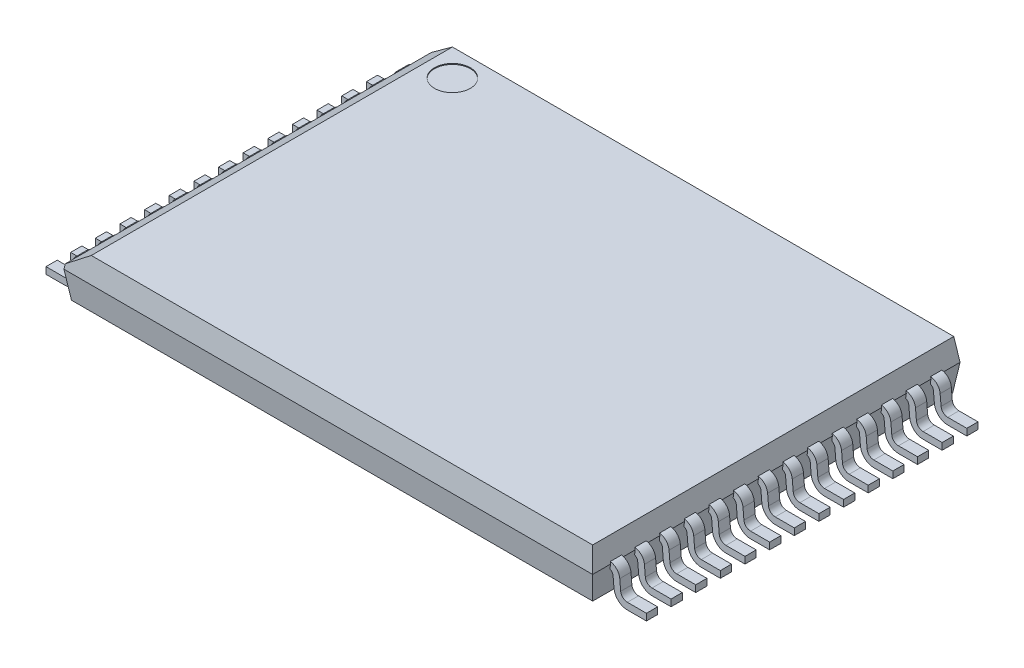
SolidWorks part; units mm, degrees
ref_plane "Front" through (0, 0, 0) normal (0, 0, 1) x (1, 0, 0)
ref_plane "Top" through (0, 0, 0) normal (0, 1, 0) x (1, 0, 0)
ref_plane "Right" through (0, 0, 0) normal (1, 0, 0) x (0, 0, -1)
ref_plane "ПлоскостьВывод1" through (0, 0, -3.575) normal (0, 0, 1) x (1, 0, 0)
sketch "ЭскизВывод1" plane through (0, 0, -3.575) normal (0, 0, 1) x (1, 0, 0)
  line L0 (-6.7, 0) -> (-6.2749, 0)
  line L1 (-5.976, 0.2739) -> (-5.9555, 0.5087)
  line L2 (-5.8559, 0.6) -> (5.8559, 0.6)
  line L3 (0, 0.6) -> (0, 0) construction
  line L4 (5.976, 0.2739) -> (5.9555, 0.5087)
  line L5 (6.7, 0) -> (6.2749, 0)
  arc A0 (-5.9555, 0.5087) -> (-5.8559, 0.6) centre (-5.8559, 0.5) cw
  arc A1 (-6.2749, 0) -> (-5.976, 0.2739) centre (-6.2749, 0.3) ccw
  arc A2 (6.2749, 0) -> (5.976, 0.2739) centre (6.2749, 0.3) cw
  arc A3 (5.9555, 0.5087) -> (5.8559, 0.6) centre (5.8559, 0.5) ccw
  point P8 (-5.9475, 0.6)
  point P11 (-6, 0)
  dimension "D6" = 0.1
  dimension "D7" = 0.3
  dimension "E" = 13.4
  dimension "A_mid_lead" = 0.6
  dimension "L" = 0.7
  dimension "D4" = 85
  dimension "D5" = 11.895
extrude "Вывод1" add sketch "ЭскизВывод1" along normal mid plane 0.25 thin
ref_plane "ПлоскостьКорпус" through (0, 0.7, 0) normal (0, 1, 0) x (-1, 0, 0)
sketch "ЭскизКорпус" plane through (0, 0.7, 0) normal (0, 1, 0) x (1, 0, 0)
  line L1 (5.9, -4.1) -> (-5.9, -4.1)
  line L2 (5.9, -4.1) -> (5.9, 4.1)
  line L3 (5.9, 4.1) -> (-5.9, 4.1)
  line L4 (-5.9, -4.1) -> (-5.9, 4.1)
  line L5 (5.9, -4.1) -> (-5.9, 4.1) construction
  line L6 (5.9, 4.1) -> (-5.9, -4.1) construction
  point P0 (0, 0)
  dimension "D" = 8.2
  dimension "E" = 11.8
extrude "Корпус" add sketch "ЭскизКорпус" along normal offset from surface 1.2 draft 8 and the other way offset from surface (0.6 mm away) 0.1 draft 8
pattern_linear "Выводы" count 14 spacing 0.55 along (0, 0, 1) of "Вывод1"
chamfer "Фаска1" distance 0.4 angle 45 1 edges at (-5.8297, 1.2, 0)
sketch "Эскиз3" plane through (0, 1.2, 0) normal (0, 1, 0) x (1, 0, 0)
  line L0 (-5.3597, 3.4297) -> (-4.7597, 3.4297) construction
  line L1 (-5.3597, 4.0297) -> (-5.3597, -4.0297) construction
  line L2 (-4.7597, 3.4297) -> (-4.7597, 4.0297) construction
  line L3 (5.8297, 4.0297) -> (-5.3597, 4.0297) construction
  circle A0 centre (-4.7597, 3.4297) radius 0.4
  dimension "D2" = 0.8
  dimension "D1" = 0.6
extrude "Вытянуть3" cut sketch "Эскиз3" against normal blind 0.02
sketch "SkThermalPad" plane through (0, 0.7, 0) normal (0, 1, 0) x (-1, 0, 0)
  line L1 (1.25, 1.25) -> (-1.25, 1.25)
  line L2 (1.25, 1.25) -> (1.25, -1.25)
  line L3 (1.25, -1.25) -> (-1.25, -1.25)
  line L4 (-1.25, 1.25) -> (-1.25, -1.25)
  line L5 (1.25, 1.25) -> (-1.25, -1.25) construction
  line L6 (1.25, -1.25) -> (-1.25, 1.25) construction
  point P0 (0, 0)
  dimension "D1" = 2.5
  dimension "E2" = 2.5
extrude "ThermalPad" [suppressed] add sketch "SkThermalPad" against normal up to surface (0.95 mm away)
